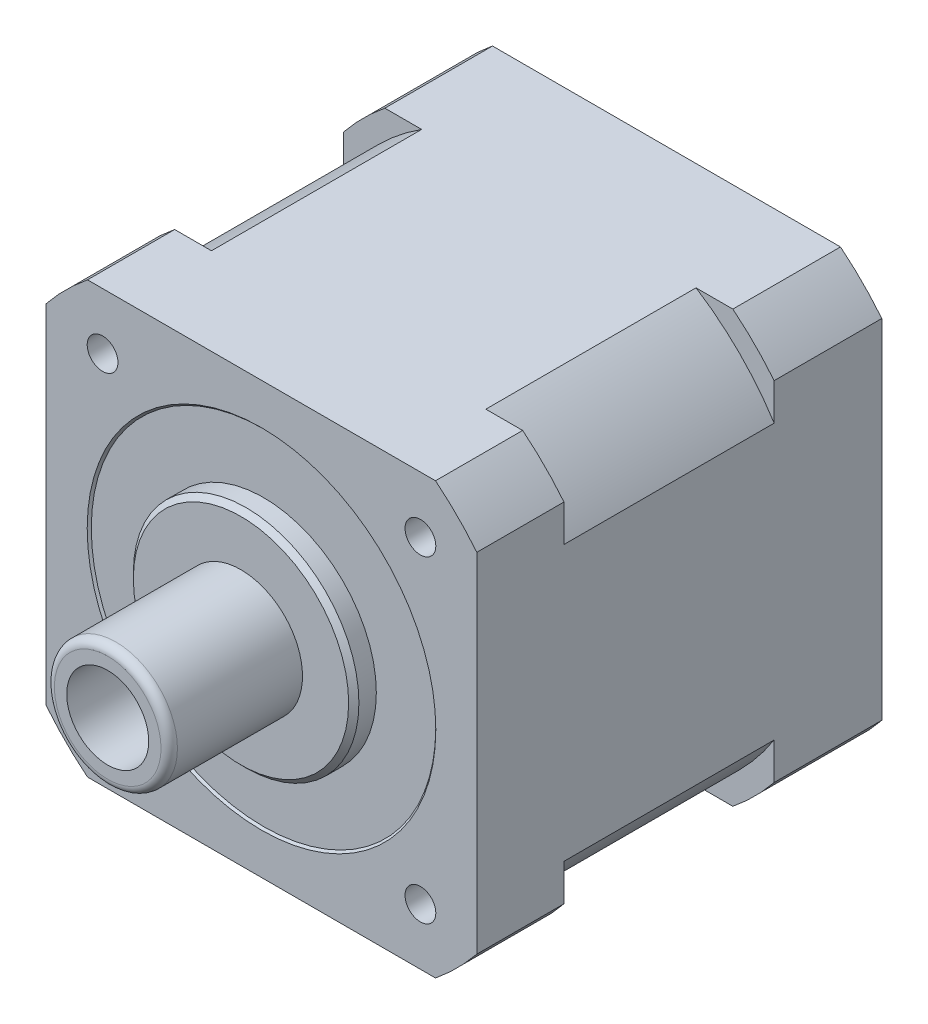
SolidWorks part; units mm, degrees
ref_plane "正面" through (0, 0, 0) normal (0, 0, 1) x (1, 0, 0)
ref_plane "平面" through (0, 0, 0) normal (0, 1, 0) x (1, 0, 0)
ref_plane "右側面" through (0, 0, 0) normal (1, 0, 0) x (0, 0, -1)
sketch "ｽｹｯﾁ1" plane through (0, 0, 0) normal (0, 0, 1) x (1, 0, 0)
  circle A0 centre (0, 0) radius 6
  dimension "D1" = 12
extrude "押し出し1" add sketch "ｽｹｯﾁ1" along normal blind 13
sketch "ｽｹｯﾁ2" plane through (0, 0, 0) normal (0, 0, -1) x (-1, 0, 0)
  circle A0 centre (0, 0) radius 11
  dimension "D1" = 22
extrude "押し出し2" add sketch "ｽｹｯﾁ2" along normal blind 2
sketch "ｽｹｯﾁ3" plane through (0, 0, -2) normal (0, 0, -1) x (-1, 0, 0)
  line L1 (-21, 21) -> (21, 21)
  line L2 (-21, 21) -> (-21, -21)
  line L3 (-21, -21) -> (21, -21)
  line L4 (21, 21) -> (21, -21)
  line L5 (-21, 21) -> (21, -21) construction
  line L6 (-21, -21) -> (21, 21) construction
  point P0 (0, 0)
  point P6 (0, 0)
  dimension "D1" = 42
  dimension "D2" = 42
extrude "押し出し3" add sketch "ｽｹｯﾁ3" along normal blind 8.5
sketch "Sketch8" plane through (0, 0, -2) normal (0, 0, 1) x (1, 0, 0)
  circle A0 centre (0, 0) radius 27
  dimension "D1" = 54
extrude "Extrude8" cut sketch "Sketch8" against normal blind 34 flip side to cut
sketch "Sketch9" plane through (0, 0, -10.5) normal (0, 0, -1) x (-1, 0, 0)
  line L4 (-21, 16.9706) -> (-21, -16.9706) construction
  line L5 (-16.9706, -21) -> (16.9706, -21) construction
  line L6 (21, -16.9706) -> (21, 16.9706) construction
  line L7 (16.9706, 21) -> (-16.9706, 21) construction
  line L8 (-21, 13.3795) -> (-21, -13.3795)
  line L9 (-13.3795, -21) -> (13.3795, -21)
  line L10 (21, -13.3795) -> (21, 13.3795)
  line L11 (13.3795, 21) -> (-13.3795, 21)
  arc A1 (21, 13.3795) -> (13.3795, 21) centre (0, 0) ccw
  arc A2 (-13.3795, 21) -> (-21, 13.3795) centre (0, 0) ccw
  arc A3 (-21, -13.3795) -> (-13.3795, -21) centre (0, 0) ccw
  arc A4 (13.3795, -21) -> (21, -13.3795) centre (0, 0) ccw
  dimension "D1" = 49.8
extrude "Extrude9" add sketch "Sketch9" along normal blind 20.5
sketch "Sketch14" plane through (0, 0, -2) normal (0, 0, 1) x (1, 0, 0)
  line L5 (15.5, -15.5) -> (-15.5, 15.5) construction
  line L6 (15.5, 15.5) -> (-15.5, -15.5) construction
  circle A0 centre (-15.5, 15.5) radius 1.5
  circle A1 centre (15.5, 15.5) radius 1.5
  circle A2 centre (15.5, -15.5) radius 1.5
  circle A3 centre (-15.5, -15.5) radius 1.5
  point P0 (0, 0)
  dimension "D3" = 3
  dimension "D4" = 3
  dimension "D5" = 3
  dimension "D6" = 3
  dimension "D1" = 31
  dimension "D2" = 31
  dimension "D7" = 15.5
  dimension "D8" = 15.5
  dimension "D9" = 31
  dimension "D10" = 31
extrude "Extrude13" cut sketch "Sketch14" against normal blind 4.5
sketch "Sketch11" plane through (0, 0, -31) normal (0, 0, -1) x (-1, 0, 0)
  line L12 (21, -21) -> (-21, -21)
  line L13 (21, -21) -> (21, 21)
  line L14 (21, 21) -> (-21, 21)
  line L15 (-21, -21) -> (-21, 21)
  line L16 (21, -21) -> (-21, 21) construction
  line L17 (21, 21) -> (-21, -21) construction
  arc A4 (-21, -16.9706) -> (-16.9706, -21) centre (0, 0) ccw
  arc A5 (-16.9706, 21) -> (-21, 16.9706) centre (0, 0) ccw
  arc A6 (21, 16.9706) -> (16.9706, 21) centre (0, 0) ccw
  arc A7 (16.9706, -21) -> (21, -16.9706) centre (0, 0) ccw
  dimension "D1" = 54
  dimension "D2" = 42
  dimension "D3" = 42
extrude "Extrude11" add sketch "Sketch11" along normal blind 10.5 contours M8 M1 M2 M3 M4 M5 M6 M7 | L14 A5 L15 M7 | L13 A6 L14 M5 | L12 A7 L13 M3 | L15 A4 L12 M1
sketch "Sketch6" plane through (0, 0, -2) normal (0, 0, 1) x (1, 0, 0)
  circle A0 centre (0, 0) radius 16.5
  circle A1 centre (0, 0) radius 11 construction
  circle A2 centre (0, 0) radius 11
  dimension "D2" = 33
extrude "Extrude6" cut sketch "Sketch6" against normal blind 0.2
chamfer "Chamfer8" distance 0.5 angle 45 1 edges at (16.5, 0, -2)
chamfer "Chamfer2" distance 0.5 angle 45 1 edges at (-11, 0, 0)
sketch "Sketch15" plane through (0, 0, -41.5) normal (0, 0, -1) x (-1, 0, 0)
  circle A0 centre (0, 0) radius 6
  dimension "D1" = 12
extrude "Extrude14" add sketch "Sketch15" along normal blind 15
fillet "Fillet1" radius 0.8 2 edges at (6, 0, 13) (-6, 0, -56.5)
sketch "Sketch16" plane through (0, 0, 13) normal (0, 0, 1) x (1, 0, 0)
  circle A0 centre (0, 0) radius 4
  dimension "D1" = 8
extrude "Extrude17" cut sketch "Sketch16" against normal up to surface (69.5 mm away)
